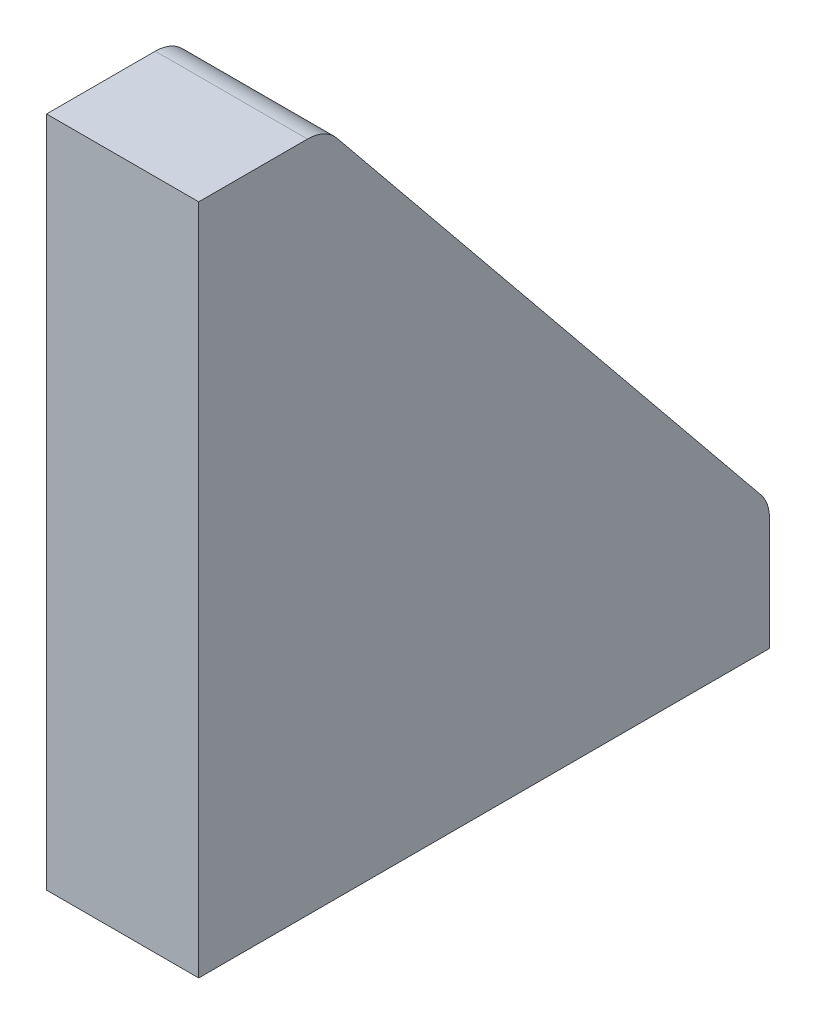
SolidWorks part; units mm, degrees
ref_plane "Front Plane" through (0, 0, 0) normal (0, 0, 1) x (1, 0, 0)
ref_plane "Top Plane" through (0, 0, 0) normal (0, 1, 0) x (1, 0, 0)
ref_plane "Right Plane" through (0, 0, 0) normal (1, 0, 0) x (0, 0, -1)
sketch "Sketch1" plane through (0, 0, 0) normal (1, 0, 0) x (0, 0, -1)
  line L0 (45, 0) -> (0, 0)
  line L1 (55, 0) -> (-55, 0) construction
  line L2 (0, 0) -> (0, 53)
  line L3 (0, 55) -> (0, -55) construction
  line L4 (0, 53) -> (8.5737, 53)
  line L5 (10.9004, 51.8938) -> (44.3267, 10.8272)
  line L6 (45, 8.9334) -> (45, 0)
  arc A0 (44.3267, 10.8272) -> (45, 8.9334) centre (42, 8.9334) cw
  arc A1 (8.5737, 53) -> (10.9004, 51.8938) centre (8.5737, 50) cw
  point P12 (45, 10)
  point P15 (10, 53)
  dimension "D5" = 3
  dimension "D1" = 45
  dimension "D2" = 53
  dimension "D3" = 10
  dimension "D4" = 10
extrude "Boss-Extrude1" add sketch "Sketch1" along normal blind 12
